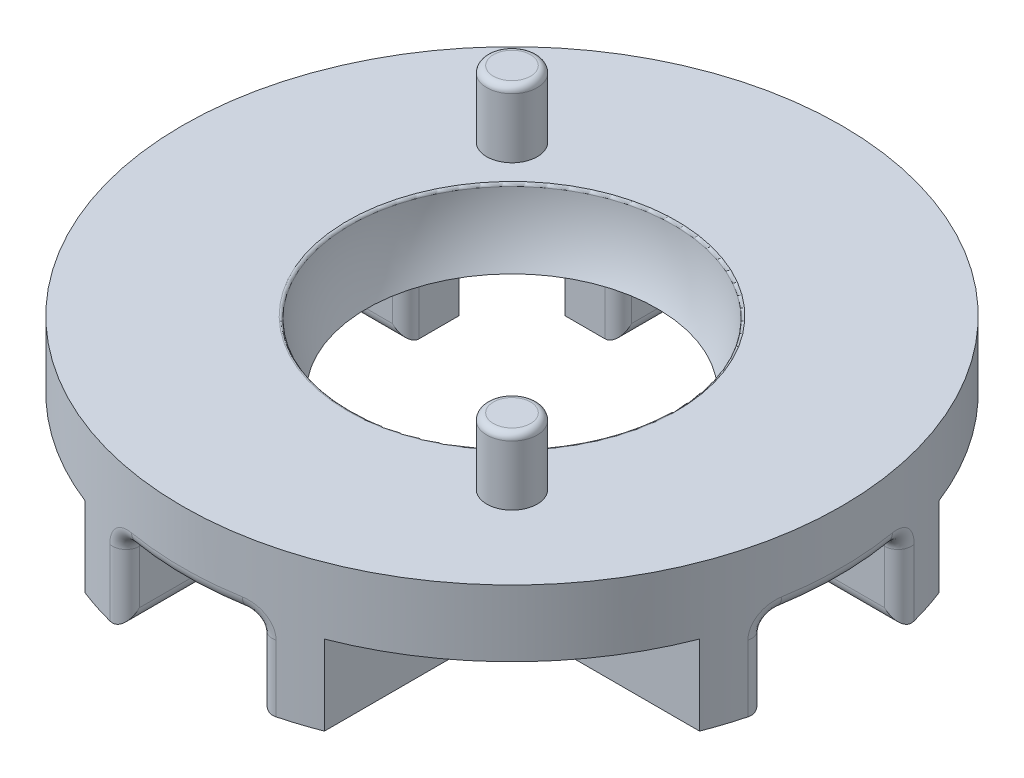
SolidWorks part; units mm, degrees
ref_plane "Front Plane" through (0, 0, 0) normal (0, 0, 1) x (1, 0, 0)
ref_plane "Top Plane" through (0, 0, 0) normal (0, 1, 0) x (1, 0, 0)
ref_plane "Right Plane" through (0, 0, 0) normal (1, 0, 0) x (0, 0, -1)
sketch "Sketch1" plane through (0, 0, 0) normal (0, 0, 1) x (1, 0, 0)
  line L0 (0, 0) -> (0, 4.2142) construction
  line L1 (6.0967, -0.2) -> (12.4, -0.2)
  line L3 (5.4699, -2.7) -> (12.4, -2.7)
  line L4 (12.4, -0.2) -> (12.4, -2.7)
  arc A0 (5.4699, -2.7) -> (6.0967, -0.2) centre (0, 0) ccw
  dimension "D1" = 12.2
  dimension "D2" = 2.5
  dimension "D3" = 0.2
  dimension "D4" = 12.4
revolve "Revolve1" add sketch "Sketch1" angle 360 about L0
sketch "Sketch2" plane through (0, 0, 0) normal (1, 0, 0) x (0, 0, -1)
  line L0 (12.4, -0.2) -> (-12.4, -0.2) construction
  line L1 (-8, -0.2) -> (-5.5, -0.2)
  line L2 (-8, -0.2) -> (-8, -0.4)
  line L3 (-8, -0.4) -> (-5.5, -0.4)
  line L4 (-5.5, -0.2) -> (-5.5, -0.4)
  line L5 (0, 0) -> (0, 3.3874) construction
  line L6 (5.5, -0.2) -> (5.5, -0.4)
  line L7 (8, -0.4) -> (5.5, -0.4)
  line L8 (8, -0.2) -> (8, -0.4)
  line L9 (8, -0.2) -> (5.5, -0.2)
  dimension "D1" = 5.5
  dimension "D2" = 0.2
  dimension "D3" = 2.5
sketch "Sketch3" plane through (0, -0.2, 0) normal (0, 1, 0) x (1, 0, 0)
  line L0 (-6.3862, -5.1833) -> (-3.6098, -2.4069)
ref_plane "Plane1" through (-0.6014, 0, -0.6014) normal (0.7071, 0, 0.7071) x (0.7071, 0, -0.7071)
sketch "Sketch4" plane through (-0.6014, 0, -0.6014) normal (0.7071, 0, 0.7071) x (0.7071, 0, -0.7071)
  line L0 (-8.1809, -0.2) -> (-4.2544, -0.2) construction
  line L1 (-6.5, -0.2) -> (-4, -0.2)
  line L2 (-6.5, -0.2) -> (-6.5, -0.7)
  line L3 (-6.5, -0.7) -> (-4, -0.7)
  line L4 (-4, -0.2) -> (-4, -0.7)
  line L5 (0, 0) -> (0, 3.0786) construction
  line L6 (4, -0.2) -> (4, -0.7)
  line L7 (6.5, -0.7) -> (4, -0.7)
  line L8 (6.5, -0.2) -> (6.5, -0.7)
  line L9 (6.5, -0.2) -> (4, -0.2)
  dimension "D1" = 2.5
  dimension "D2" = 0.5
  dimension "D3" = 4
sketch "Sketch7" plane through (0, -0.2, 0) normal (0, 1, 0) x (1, 0, 0)
  line L0 (0, 0) -> (-5.6569, 5.6569) construction
  line L1 (0, 0) -> (5.6569, -5.6569) construction
  line L2 (0, 0) -> (3.5969, 0) construction
  circle A0 centre (0, 0) radius 8 construction
  circle A1 centre (-5.6569, 5.6569) radius 0.95
  circle A2 centre (5.6569, -5.6569) radius 0.95
  dimension "D1" = 16
  dimension "D2" = 1.9
  dimension "D3" = 1.9
  dimension "D4" = 45
  dimension "D5" = 135
extrude "Boss-Extrude1" add sketch "Sketch7" along normal blind 2.5
sketch "Sketch8" plane through (0, -2.7, 0) normal (0, -1, 0) x (1, 0, 0)
  line L0 (-12.4, 0) -> (-11, 0) construction
  line L1 (0, 0) -> (0, 3.4976) construction
  line L2 (-4, 11) -> (4, 11)
  line L3 (-4, 11) -> (-4, 10)
  line L4 (-4, 10) -> (-2.75, 10)
  line L7 (-11, -4) -> (-11, 4)
  line L8 (-11, 4) -> (-10, 4)
  line L9 (-10, -4) -> (-10, -2.75)
  line L10 (4, 11) -> (4, 10)
  line L11 (-8.5, 0) -> (8.5, 0) construction
  line L12 (10, -4) -> (10, -2.75)
  line L13 (11, 4) -> (10, 4)
  line L14 (11, -4) -> (11, 4)
  line L15 (4, -11) -> (4, -10)
  line L16 (-4, -10) -> (-2.75, -10)
  line L17 (-4, -11) -> (-4, -10)
  line L18 (-4, -11) -> (4, -11)
  line L19 (11, -4) -> (10, -4)
  line L20 (-11, -4) -> (-10, -4)
  line L37 (2.75, 10) -> (4, 10)
  line L38 (10, 2.75) -> (10, 4)
  line L39 (-10, 2.75) -> (-10, 4)
  line L40 (2.75, -10) -> (4, -10)
  line L41 (-2.75, 10) -> (2.75, 10)
  line L42 (11, 0) -> (12.4, 0) construction
  line L43 (-10, 2.75) -> (-10, -2.75)
  line L44 (10, 2.75) -> (10, -2.75)
  line L45 (2.75, -10) -> (-2.75, -10)
  circle A0 centre (0, 0) radius 12.4 construction
  point P19 (0, 10)
  point P20 (0, 11)
  point P29 (0, -11)
  point P30 (0, -10)
  point P32 (11, 0)
  point P33 (10, 0)
  dimension "D1" = 10
  dimension "D2" = 1
  dimension "D3" = 4
  dimension "D5" = 10
  dimension "D6" = 1
fillet "Fillet1" radius 0.25 2 edges at (-5.6569, 2.3, -4.7069) (5.6569, 2.3, 6.6069)
sketch "Sketch9" plane through (0, -2.7, 0) normal (0, -1, 0) x (1, 0, 0)
  line L0 (-2.5, 12.8138) -> (-2.5, 12.1454) construction
  line L1 (-4.5, 12.8138) -> (-2.5, 12.8138) construction
  line L2 (-4.5, 11.5547) -> (-4.5, 6.5)
  line L3 (-4.5, 6.5) -> (-2.5, 6.5)
  line L4 (-2.5, 12.1454) -> (-2.5, 6.5)
  line L5 (2.5, 12.8138) -> (4.5, 12.8138) construction
  line L6 (2.5, 12.1454) -> (2.5, 6.5)
  line L7 (2.5, 6.5) -> (4.5, 6.5)
  line L8 (4.5, 11.5547) -> (4.5, 6.5)
  line L9 (-4.5, 12.8138) -> (-4.5, 11.5547) construction
  line L10 (2.5, 12.8138) -> (2.5, 12.1454) construction
  line L11 (4.5, 12.8138) -> (4.5, 11.5547) construction
  arc A0 (4.5, 11.5547) -> (2.5, 12.1454) centre (0, 0) ccw
  arc A1 (-4.5, 11.5547) -> (4.5, 11.5547) centre (0, 0) ccw construction
  arc A2 (2.5, 12.1454) -> (-2.5, 12.1454) centre (0, 0) ccw construction
  arc A3 (-2.5, 12.1454) -> (-4.5, 11.5547) centre (0, 0) ccw
  dimension "D3" = 24.8
  dimension "D1" = 5
  dimension "D2" = 2.5
  dimension "D4" = 2
  dimension "D5" = 2
  dimension "D6" = 6.5
extrude "Boss-Extrude3" add sketch "Sketch9" along normal blind 3
fillet "Fillet2" radius 0.5 11 edges at (-3.5, -2.7, 6.5) (3.5, -2.7, 6.5) (-2.5, -2.7, 9.3227) (2.5, -2.7, 9.3227) (2.5, -5.7, 9.3227) (-2.5, -5.7, 9.3227) (0, -2.7, 12.4) (2.5, -4.2, 6.5) (2.5, -4.2, 12.1454) (-2.5, -4.2, 6.5) (-2.5, -4.2, 12.1454)
pattern_circular "CirPattern1" count 4 over 360 about axis through (0, 0, 0) along (0, 1, 0) of "Boss-Extrude3", "Fillet2"
fillet "Fillet3" radius 0.1 1 edges at (0, -0.2, -6.0967)
